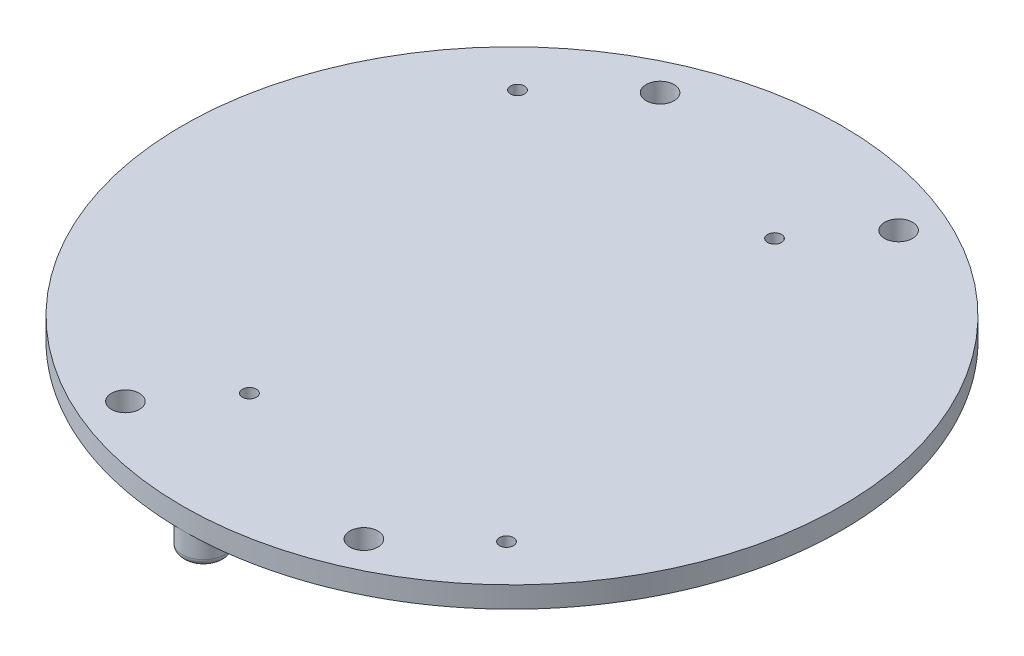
SolidWorks part; units mm, degrees
other "<a_base>-<Holes Pattern>"
ref_plane "Front Plane" through (0, 0, 0) normal (0, 0, 1) x (1, 0, 0)
ref_plane "Top Plane" through (0, 0, 0) normal (0, 1, 0) x (1, 0, 0)
ref_plane "Right Plane" through (0, 0, 0) normal (1, 0, 0) x (0, 0, -1)
inserted part "a_base"
sketch "Sketch1" plane through (0, -1.5, 0) normal (0, -1, 0) x (1, 0, 0)
  line L0 (27.5, 28.2843) -> (-9.1667, 28.2843) construction
  line L1 (9.1667, -28.2843) -> (-27.5, -28.2843) construction
  line L2 (9.1667, 28.2843) -> (-9.1667, -28.2843) construction
  line L3 (0, 0) -> (-44.7105, 14.4903) construction
  line L4 (0.1764, 16.7621) -> (-7.4339, 19.2286)
  line L5 (-7.4339, 19.2286) -> (-17.2996, -11.2127)
  line L6 (1.1013, 19.616) -> (-35.0366, 31.3279)
  line L7 (-20.1535, -10.2878) -> (-10.2878, 20.1535)
  line L8 (-10.2878, 20.1535) -> (-26.4596, 25.3946)
  line L9 (-26.4596, 25.3946) -> (-36.3254, -5.0466)
  line L10 (-39.1792, -4.1217) -> (-29.3135, 26.3195)
  line L11 (-29.3135, 26.3195) -> (-37.1072, 28.8454)
  line L12 (-7.4339, 19.2286) -> (-10.2878, 20.1535) construction
  line L13 (-26.4596, 25.3946) -> (-29.3135, 26.3195) construction
  line L14 (1.1013, 19.616) -> (0.1764, 16.7621)
  line L15 (-39.1792, -4.1217) -> (-46.9729, -1.5958)
  line L16 (-20.1535, -10.2878) -> (-36.3254, -5.0466)
  line L17 (-9.6893, -13.6791) -> (-17.2996, -11.2127)
  line L18 (-10.6142, -16.533) -> (-46.7521, -4.821)
  line L19 (-10.6142, -16.533) -> (-9.6893, -13.6791)
  circle A0 centre (0, 0) radius 47 construction
  arc A1 (-35.0366, 31.3279) -> (-37.1072, 28.8454) centre (0, 0) ccw
  arc A2 (-46.7521, -4.821) -> (-46.9729, -1.5958) centre (0, 0) cw
  point P30 (-34.2464, 11.0989)
  point P31 (-31.3925, 10.174)
  point P32 (-15.2206, 4.9329)
  point P33 (-12.3667, 4.0079)
  dimension "D1" = 3
  dimension "D2" = 16
  dimension "D3" = 23
  dimension "D4" = 36
  dimension "D5" = 8
extrude "Servo Standoff" add sketch "Sketch1" along normal blind 8 contours L18 L19 L17 L5 L4 L14 L6 L11 L10 L15 L7 L16 L9 L8 M12
sketch "Sketch3" plane through (5.8578, 0, 18.0745) normal (0.3083, 0, 0.9513) x (0.9513, 0, -0.3083)
  line L0 (-5, -1.5) -> (-5, -9.5)
  line L1 (-5, -9.5) -> (-13, -9.5)
  line L3 (-5, -9.5) -> (-42.9884, -9.5) construction
  line L4 (-36, -9.5) -> (-44.1928, -9.5)
  line L6 (-44, -1.5) -> (-44.1928, -1.5)
  line L7 (-44.1928, -1.5) -> (-44.1928, -9.5)
  line L8 (-5, -1.5) -> (-42.9884, -1.5) construction
  arc A0 (-5, -1.5) -> (-13, -9.5) centre (-5, -9.5) ccw
  arc A1 (-36, -9.5) -> (-44, -1.5) centre (-44, -9.5) ccw
  dimension "D1" = 23
extrude "Servo Standoff Side Cut" cut sketch "Sketch3" against normal through all
sketch "Sketch2" plane through (0, -1.5, 0) normal (0, -1, 0) x (1, 0, 0)
  line L0 (0, 0) -> (-12.3667, 4.0079) construction
  line L1 (-7.4339, 19.2286) -> (-17.2996, -11.2127) construction
  line L2 (-6.7823, 7.4541) -> (9.8653, 2.0588)
  line L3 (9.8653, 2.0588) -> (6.7823, -7.4541)
  line L4 (6.7823, -7.4541) -> (-9.8653, -2.0588)
  line L5 (-6.7823, 7.4541) -> (-9.8653, -2.0588)
  line L6 (0, 0) -> (-14.4903, -44.7105) construction
  line L7 (14.8332, 3.6024) -> (-9.9003, 11.6183)
  line L8 (-9.9003, 11.6183) -> (-14.8332, -3.6024)
  line L9 (-14.8332, -3.6024) -> (9.9003, -11.6183)
  line L10 (9.9003, -11.6183) -> (14.8332, 3.6024)
  arc A0 (-46.7521, -4.821) -> (-35.0366, 31.3279) centre (0, 0) ccw construction
  dimension "D1" = 10
  dimension "D2" = 17.5
  dimension "D3" = 3
extrude "Servo Top" add sketch "Sketch2" along normal blind 5
sketch "Sketch7" plane through (2.4664, 0, 7.6103) normal (0.3083, 0, 0.9513) x (0.9513, 0, -0.3083)
  line L0 (0, -1.5) -> (0, -6.5) construction
  line L1 (13, -1.5) -> (-13, -1.5) construction
  line L2 (-13, -6.5) -> (13, -6.5) construction
  line L3 (-13, -3.5) -> (0, -3.5)
  line L4 (-13, -6.5) -> (-13, -1.5) construction
  line L5 (-13, -3.5) -> (-13, -6.5)
  line L6 (0, -4) -> (13, -4) construction
  line L7 (13, -6.5) -> (13, -1.5) construction
  line L8 (6.5, -4) -> (6.5, -6.5) construction
  line L9 (-13, -6.5) -> (6.5, -6.5)
  arc A0 (0, -3.5) -> (6.5, -6.5) centre (0, -12.0417) cw
  dimension "D1" = 2
extrude "Servo Top Side Cut" cut sketch "Sketch7" against normal up to surface (16 mm away)
sketch "Sketch8" plane through (0, -6.5, 0) normal (0, -1, 0) x (1, 0, 0)
  circle A0 centre (9.8653, 2.0588) radius 0.5
  circle A1 centre (6.7823, -7.4541) radius 0.5
  circle A2 centre (-6.7823, 7.4541) radius 0.5
  circle A3 centre (-9.8653, -2.0588) radius 0.5
  dimension "D1" = 1
extrude "Allowance Holes" cut sketch "Sketch8" against normal up to surface (5 mm away)
fillet "Allowance Fillets" radius 1 12 edges at (-6.9364, -2.5, 6.9785) (-6.3066, -2.5, 7.2999) (-9.7111, -2.5, -1.5831) (-9.3896, -2.5, -2.2129) (6.3066, -4, -7.2999) (6.9364, -4, -6.9785) (9.7111, -4, 1.5831) (9.3896, -4, 2.2129) (9.9003, -4, -11.6183) (14.8332, -4, 3.6024) (4.1794, -6.5, -8.1873) (8.1873, -6.5, 4.1794)
sketch "Sketch11" plane through (0, -1.5, 0) normal (0, -1, 0) x (1, 0, 0)
  line L0 (17.0093, 38.128) -> (-17.0093, 38.128) construction
  line L1 (17.0093, -38.128) -> (-17.0093, -38.128) construction
  line L2 (0, 0) -> (47, 0) construction
  line L3 (0, 0) -> (0, 47) construction
  circle A1 centre (0, 44) radius 3
  circle A2 centre (0, -44) radius 3
  arc A3 (-46.7521, -4.821) -> (-35.0366, 31.3279) centre (0, 0) ccw construction
  dimension "D1" = 6
sketch "Sketch10" plane through (0, -9.5, 0) normal (0, -1, 0) x (1, 0, 0)
  line L0 (-6.509, 22.0824) -> (-28.3886, 29.1734)
  line L1 (-28.3886, 29.1734) -> (-29.3135, 26.3195)
  line L2 (-29.3135, 26.3195) -> (-7.4339, 19.2286)
  line L3 (-7.4339, 19.2286) -> (-6.509, 22.0824)
  line L4 (-18.2245, -14.0665) -> (-40.1041, -6.9755)
  line L5 (-40.1041, -6.9755) -> (-39.1792, -4.1217)
  line L6 (-39.1792, -4.1217) -> (-17.2996, -11.2127)
  line L7 (-17.2996, -11.2127) -> (-18.2245, -14.0665)
extrude "Servo Standoff Legs" add sketch "Sketch10" along normal blind 3
extrude "Shell Pins" add sketch "Sketch11" along normal blind 4
fillet "Fillet1" radius 1 2 edges at (0, -5.5, -41) (0, -5.5, 41)
equation "\"D1@Sketch1\"=\"width keep@values@params.sldprt\""
equation "\"D3@Sketch2\"=\"width keep@values@params.sldprt\""
equation "\"D1@Sketch11\"=2*\"width keep@values@params.sldprt\""
